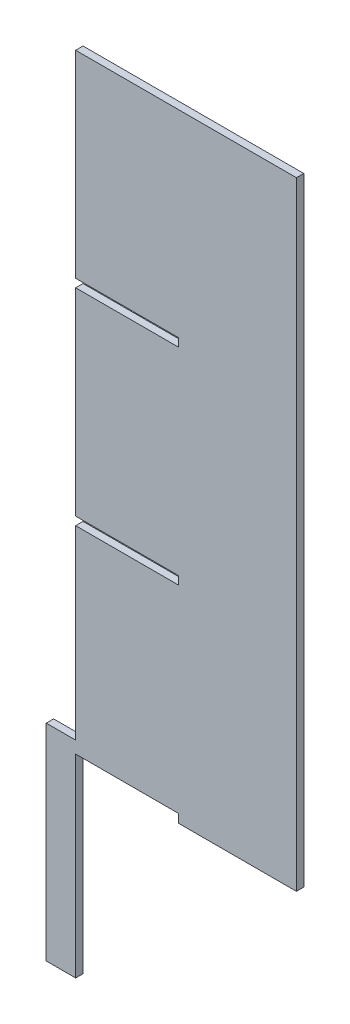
SolidWorks part; units mm, degrees
ref_plane "Front Plane" through (0, 0, 0) normal (0, 0, 1) x (1, 0, 0)
ref_plane "Top Plane" through (0, 0, 0) normal (0, 1, 0) x (1, 0, 0)
ref_plane "Right Plane" through (0, 0, 0) normal (1, 0, 0) x (0, 0, -1)
sketch "Sketch1" plane through (0, 0, 0) normal (0, 0, 1) x (1, 0, 0)
  line L0 (24.501, -1.5) -> (64.501, -1.5)
  line L1 (64.501, -1.5) -> (64.501, 208.5)
  line L2 (64.501, 208.5) -> (-10.499, 208.5)
  line L3 (-10.499, 208.5) -> (-10.499, 141.4)
  line L7 (-10.499, 141.4) -> (24.501, 141.4)
  line L8 (24.501, 141.4) -> (24.501, 138.6)
  line L9 (24.501, 138.6) -> (-10.499, 138.6)
  line L10 (-10.499, 68.6) -> (-10.499, 5.5014)
  line L11 (-10.499, 71.4) -> (24.501, 71.4)
  line L12 (24.501, 68.6) -> (-10.499, 68.6)
  line L13 (24.501, 71.4) -> (24.501, 68.6)
  line L15 (-10.499, 1.4) -> (24.501, 1.4)
  line L17 (24.501, 1.4) -> (24.501, -1.5)
  line L19 (-10.499, 138.6) -> (-10.499, 71.4)
  line L24 (24.501, -1.4) -> (-10.499, -1.4)
  line L25 (-20.499, 5.5014) -> (-10.499, 5.5014)
  line L26 (-20.499, 5.5014) -> (-20.499, -64.4986)
  line L27 (-20.499, -64.4986) -> (-10.499, -64.4986)
  line L28 (-10.499, 1.4) -> (-10.499, -64.4986)
extrude "Boss-Extrude1" add sketch "Sketch1" along normal blind 2.5
equation "\"grosor\"=0.28"
equation "\"D4@Sketch1\"=\"grosor\""
